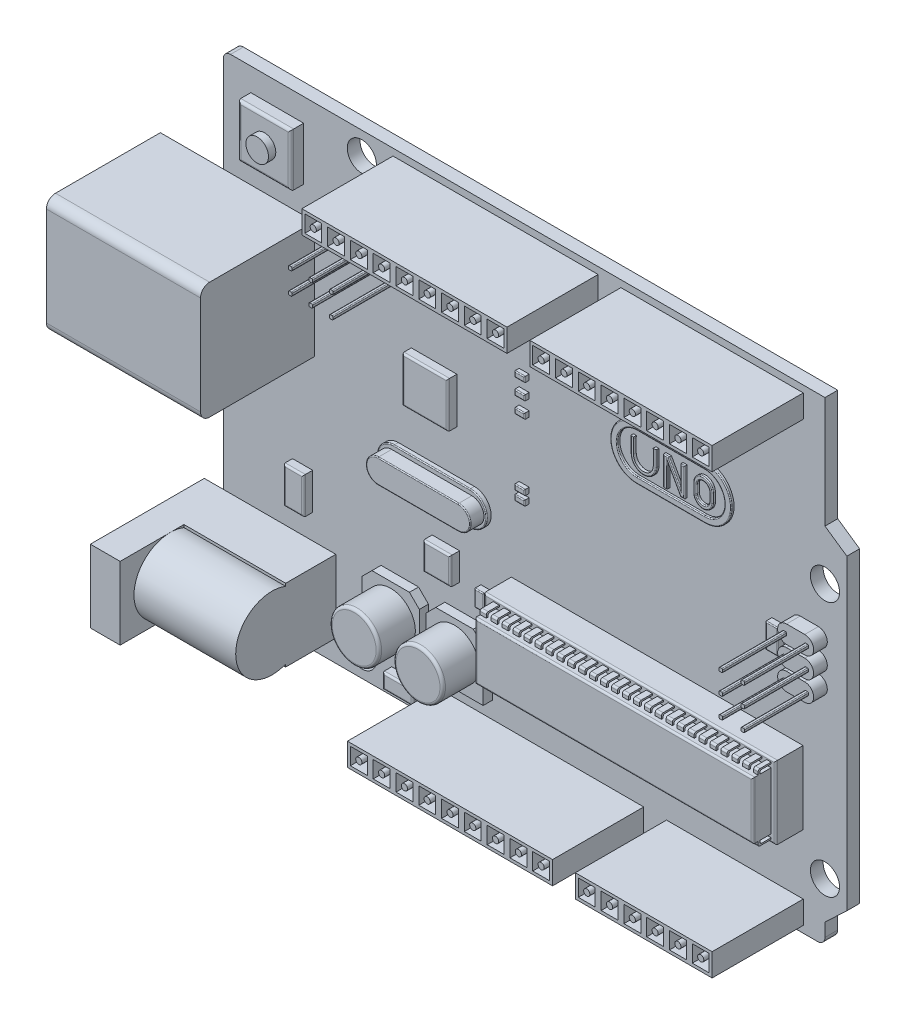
SolidWorks part; units mm, degrees
ref_plane "Front Plane" through (0, 0, 0) normal (0, 0, 1) x (1, 0, 0)
ref_plane "Top Plane" through (0, 0, 0) normal (0, 1, 0) x (1, 0, 0)
ref_plane "Right Plane" through (0, 0, 0) normal (1, 0, 0) x (0, 0, -1)
sketch "Sketch3" plane through (0, 0, 0) normal (0, 0, 1) x (1, 0, 0)
  line L0 (0, -26.04) -> (0, -19.66) construction
  line L1 (-32.2, -26.04) -> (32.2, -26.04)
  line L2 (-33, -25.24) -> (-33, 25.24)
  line L3 (-32.2, 26.04) -> (33, 26.04)
  line L4 (33, -25.24) -> (33, -23.7821)
  line L5 (-33, -26.04) -> (33, 26.04) construction
  line L6 (-33, 26.04) -> (33, -26.04) construction
  line L7 (0, -19.66) -> (45.2877, -19.66) construction
  line L9 (35.4, -19.66) -> (35.4, 12.175)
  line L10 (35.4, 12.175) -> (33, 13.8291)
  line L11 (33, 23.54) -> (-33, 23.54) construction
  line L12 (-17.8, 26.04) -> (-17.8, -26.04) construction
  line L13 (-27.8041, -21.94) -> (-33, -21.94) construction
  line L14 (35.4, -19.66) -> (35.4, -21.5172)
  line L15 (35.4, -21.5172) -> (33, -23.7821)
  line L17 (33, 13.8291) -> (33, 26.04)
  circle A0 centre (33, -19.66) radius 1.6
  circle A1 centre (33, 8.34) radius 1.6
  circle A2 centre (-17.8, 23.54) radius 1.6
  circle A3 centre (-17.8, -23.54) radius 1.6
  arc A4 (32.2, -26.04) -> (33, -25.24) centre (32.2, -25.24) ccw
  arc A5 (-33, -25.24) -> (-32.2, -26.04) centre (-32.2, -25.24) ccw
  arc A6 (-33, 25.24) -> (-32.2, 26.04) centre (-32.2, 25.24) cw
  point P0 (0, 0)
  dimension "D5" = 3.2
  dimension "D6" = 3.2
  dimension "D10" = 3.2
  dimension "D11" = 3.2
  dimension "D12" = 0.8
  dimension "D1" = 52.08
  dimension "D2" = 66
  dimension "D3" = 45.7
  dimension "D4" = 17.7
  dimension "D7" = 2.4
  dimension "D8" = 15.2
  dimension "D9" = 2.5
  dimension "D13" = 2.5
extrude "Boss-Extrude2" add sketch "Sketch3" along normal blind 1.4
sketch "Sketch4" plane through (0, 0, 1.4) normal (0, 0, 1) x (1, 0, 0)
  line L4 (33, -19.66) -> (-41.4928, -19.66) construction
  line L5 (33, 8.34) -> (-43.1807, 8.34) construction
  line L6 (-23, 2.7306) -> (-23, 1.9306)
  line L7 (-34.2816, -15.6787) -> (-21.4564, -15.6787)
  line L8 (-35.0816, -16.4787) -> (-35.0816, -22.8413)
  line L9 (-34.2816, -23.6413) -> (-21.4564, -23.6413)
  line L10 (-20.6564, -16.4787) -> (-20.6564, -22.8413)
  line L11 (-35.0816, -15.6787) -> (-20.6564, -23.6413) construction
  line L12 (-35.0816, -23.6413) -> (-20.6564, -15.6787) construction
  line L13 (-39.1023, 14.7494) -> (-23.8, 14.7494)
  line L14 (-39.9023, 13.9494) -> (-39.9023, 2.7306)
  line L15 (-39.1023, 1.9306) -> (-23.8, 1.9306)
  line L16 (-23, 13.9494) -> (-23, 2.7306)
  line L17 (-39.9023, 14.7494) -> (-23, 1.9306) construction
  line L18 (-39.9023, 1.9306) -> (-23, 14.7494) construction
  line L19 (-23, 1.9306) -> (-23.8, 1.9306)
  line L20 (-23, 13.9494) -> (-23, 14.7494)
  line L21 (-23, 14.7494) -> (-23.8, 14.7494)
  line L22 (-20.6564, -22.8413) -> (-20.6564, -23.6413)
  line L23 (-20.6564, -23.6413) -> (-21.4564, -23.6413)
  line L24 (-20.6564, -16.4787) -> (-20.6564, -15.6787)
  line L25 (-20.6564, -15.6787) -> (-21.4564, -15.6787)
  line L26 (-34.2816, -23.6413) -> (-35.0816, -23.6413)
  line L27 (-35.0816, -23.6413) -> (-35.0816, -22.8413)
  line L28 (-35.0816, -16.4787) -> (-35.0816, -15.6787)
  line L29 (-35.0816, -15.6787) -> (-34.2816, -15.6787)
  line L30 (-39.1023, 14.7494) -> (-39.9023, 14.7494)
  line L31 (-39.9023, 14.7494) -> (-39.9023, 13.9494)
  line L32 (-39.9023, 2.7306) -> (-39.9023, 1.9306)
  line L33 (-39.9023, 1.9306) -> (-39.1023, 1.9306)
  line L34 (-33, 25.24) -> (-33, -25.24) construction
  point P4 (-27.869, -19.66)
  point P11 (-31.4511, 8.34)
  dimension "D1" = 10
extrude "Boss-Extrude3" add sketch "Sketch4" along normal blind 12.5
sketch "Sketch5" plane through (0, 0, 13.9) normal (0, 0, 1) x (1, 0, 0)
  line L2 (-20.3205, -23.6413) -> (-20.3205, -15.6787)
  line L5 (-31.812, -15.6787) -> (-31.812, -23.6413)
  line L6 (-20.6564, -15.6787) -> (-33, -15.6787) construction
  line L7 (-35.0816, -23.6413) -> (-20.6564, -23.6413) construction
  line L8 (-31.812, -23.6413) -> (-20.3205, -23.6413)
  line L9 (-31.812, -15.6787) -> (-20.3205, -15.6787)
extrude "Cut-Extrude1" cut sketch "Sketch5" against normal blind 7
sketch "Sketch6" plane through (-31.812, 0, 0) normal (1, 0, 0) x (0, 0, -1)
  line L2 (-6.9, -19.66) -> (-8.4, -19.66) construction
  line L3 (-6.9, -23.6413) -> (-6.9, -15.6787) construction
  circle A1 centre (-8.4, -19.66) radius 3.9813
  dimension "D1" = 1.5
extrude "Boss-Extrude4" add sketch "Sketch6" along normal up to surface (11.1556 mm away)
sketch "Sketch8" plane through (-35.0816, 0, 0) normal (-1, 0, 0) x (0, 0, 1)
  line L0 (13.9, -19.66) -> (8.4, -19.66) construction
  line L1 (13.9, -15.6787) -> (13.9, -23.6413) construction
  line L2 (8.4, -19.66) -> (8.4, -14.4736) construction
  circle A0 centre (8.4, -19.66) radius 3
  circle A1 centre (8.4, -19.66) radius 0.7981
  dimension "D2" = 6
  dimension "D1" = 5.5
extrude "Cut-Extrude2" cut sketch "Sketch8" against normal blind 7
fillet "Fillet3" radius 0.5 1 edges at (-35.0816, -19.66, 9.1981)
sketch "Sketch9" plane through (-39.9023, 0, 0) normal (-1, 0, 0) x (0, 0, 1)
  line L0 (1.4, 8.34) -> (13.9, 8.34) construction
  line L1 (1.4, 14.7494) -> (1.4, 1.9306) construction
  line L2 (13.9, 14.7494) -> (13.9, 1.9306) construction
  line L3 (3.1, 3.6306) -> (3.1, 13.0494)
  line L4 (3.1, 13.0494) -> (9.8763, 13.0494)
  line L5 (9.8763, 13.0494) -> (12.2, 10.9476)
  line L6 (12.2, 10.9476) -> (12.2, 5.7324)
  line L7 (13.9, 14.7494) -> (1.4, 14.7494) construction
  line L8 (7.65, 8.34) -> (7.65, 13.5426) construction
  line L9 (6.1, 5.84) -> (6.1, 10.84)
  line L10 (6.1, 10.84) -> (9.2, 10.84)
  line L11 (9.2, 5.84) -> (9.2, 10.84)
  line L12 (6.1, 5.84) -> (9.2, 5.84)
  line L13 (9.8763, 3.6306) -> (12.2, 5.7324)
  line L14 (3.1, 3.6306) -> (9.8763, 3.6306)
  point P6 (7.65, 5.84)
  point P22 (7.65, 10.84)
  point P23 (9.2, 8.34)
  point P24 (6.1, 8.34)
  point P25 (12.2, 8.34)
  point P27 (3.1, 8.34)
  dimension "D1" = 1.7
  dimension "D2" = 1.7
  dimension "D3" = 1.7
  dimension "D4" = 3
  dimension "D5" = 2.5
extrude "Cut-Extrude3" cut sketch "Sketch9" against normal blind 10
fillet "Fillet4" radius 1 2 edges at (-31.4511, 14.7494, 13.9) (-31.4511, 1.9306, 13.9)
sketch "Sketch10" plane through (0, 0, 1.4) normal (0, 0, 1) x (1, 0, 0)
  line L1 (-29.9816, 23.5113) -> (-24.1816, 23.5113)
  line L2 (-29.9816, 23.5113) -> (-29.9816, 17.7113)
  line L3 (-29.9816, 17.7113) -> (-24.1816, 17.7113)
  line L4 (-24.1816, 23.5113) -> (-24.1816, 17.7113)
  line L5 (-29.9816, 23.5113) -> (-24.1816, 17.7113) construction
  line L6 (-29.9816, 17.7113) -> (-24.1816, 23.5113) construction
  point P0 (-27.0816, 20.6113)
  dimension "D1" = 5.8
  dimension "D2" = 5.8
extrude "Boss-Extrude5" add sketch "Sketch10" along normal blind 1.4
fillet "Fillet5" radius 0.3 4 edges at (-27.0816, 17.7113, 2.8) (-29.9816, 20.6113, 2.8) (-24.1816, 20.6113, 2.8) (-27.0816, 23.5113, 2.8)
sketch "Sketch11" plane through (0, 0, 2.8) normal (0, 0, 1) x (1, 0, 0)
  line L0 (-24.4816, 20.6113) -> (-29.6816, 20.6113) construction
  line L1 (-24.4816, 18.0113) -> (-24.4816, 23.2113) construction
  line L2 (-29.6816, 23.2113) -> (-29.6816, 18.0113) construction
  line L3 (-27.0816, 23.2113) -> (-27.0816, 18.0113) construction
  line L4 (-24.4816, 23.2113) -> (-29.6816, 23.2113) construction
  line L5 (-29.6816, 18.0113) -> (-24.4816, 18.0113) construction
  circle A0 centre (-27.0816, 20.6113) radius 1.2431
extrude "Boss-Extrude6" add sketch "Sketch11" along normal blind 0.8
sketch "Sketch15" plane through (0, 0, 1.4) normal (0, 0, 1) x (1, 0, 0)
  line L0 (-14.3813, 26.04) -> (-14.3813, 19.5503) construction
  line L1 (33, 26.04) -> (-32.2, 26.04) construction
  line L2 (30.6187, 26.04) -> (30.6187, 22.38) construction
  line L3 (33, 24.04) -> (-14.3813, 24.04) construction
  line L4 (33, 13.8291) -> (33, 26.04) construction
  line L5 (-9.7064, 23.1151) -> (-9.7064, 24.9649)
  line L6 (-11.8813, 22.79) -> (-14.3813, 22.79)
  line L7 (-11.8813, 22.79) -> (-11.8813, 25.29)
  line L8 (-11.8813, 25.29) -> (-14.3813, 25.29)
  line L9 (-14.3813, 22.79) -> (-14.3813, 25.29)
  line L10 (-11.8813, 22.79) -> (-14.3813, 25.29) construction
  line L11 (-11.8813, 25.29) -> (-14.3813, 22.79) construction
  line L12 (-14.0563, 23.1151) -> (-12.2064, 23.1151)
  line L13 (-14.0563, 23.1151) -> (-14.0563, 24.9649)
  line L14 (-14.0563, 24.9649) -> (-12.2064, 24.9649)
  line L15 (-12.2064, 23.1151) -> (-12.2064, 24.9649)
  line L16 (-14.0563, 23.1151) -> (-12.2064, 24.9649) construction
  line L17 (-14.0563, 24.9649) -> (-12.2064, 23.1151) construction
  line L18 (-11.5563, 24.9649) -> (-9.7064, 24.9649)
  line L19 (-11.5563, 23.1151) -> (-11.5563, 24.9649)
  line L20 (-11.5563, 23.1151) -> (-9.7064, 23.1151)
  line L21 (-9.3813, 22.79) -> (-9.3813, 25.29)
  line L22 (-9.3813, 25.29) -> (-11.8813, 25.29)
  line L23 (-11.8813, 22.79) -> (-11.8813, 25.29)
  line L24 (-9.3813, 22.79) -> (-11.8813, 22.79)
  line L25 (-7.2064, 23.1151) -> (-7.2064, 24.9649)
  line L26 (-9.0563, 24.9649) -> (-7.2064, 24.9649)
  line L27 (-9.0563, 23.1151) -> (-9.0563, 24.9649)
  line L28 (-9.0563, 23.1151) -> (-7.2064, 23.1151)
  line L29 (-6.8813, 22.79) -> (-6.8813, 25.29)
  line L30 (-6.8813, 25.29) -> (-9.3813, 25.29)
  line L31 (-9.3813, 22.79) -> (-9.3813, 25.29)
  line L32 (-6.8813, 22.79) -> (-9.3813, 22.79)
  line L33 (-4.7064, 23.1151) -> (-4.7064, 24.9649)
  line L34 (-6.5563, 24.9649) -> (-4.7064, 24.9649)
  line L35 (-6.5563, 23.1151) -> (-6.5563, 24.9649)
  line L36 (-6.5563, 23.1151) -> (-4.7064, 23.1151)
  line L37 (-4.3813, 22.79) -> (-4.3813, 25.29)
  line L38 (-4.3813, 25.29) -> (-6.8813, 25.29)
  line L39 (-6.8813, 22.79) -> (-6.8813, 25.29)
  line L40 (-4.3813, 22.79) -> (-6.8813, 22.79)
  line L41 (-2.2064, 23.1151) -> (-2.2064, 24.9649)
  line L42 (-4.0563, 24.9649) -> (-2.2064, 24.9649)
  line L43 (-4.0563, 23.1151) -> (-4.0563, 24.9649)
  line L44 (-4.0563, 23.1151) -> (-2.2064, 23.1151)
  line L45 (-1.8813, 22.79) -> (-1.8813, 25.29)
  line L46 (-1.8813, 25.29) -> (-4.3813, 25.29)
  line L47 (-4.3813, 22.79) -> (-4.3813, 25.29)
  line L48 (-1.8813, 22.79) -> (-4.3813, 22.79)
  line L49 (0.2936, 23.1151) -> (0.2936, 24.9649)
  line L50 (-1.5563, 24.9649) -> (0.2936, 24.9649)
  line L51 (-1.5563, 23.1151) -> (-1.5563, 24.9649)
  line L52 (-1.5563, 23.1151) -> (0.2936, 23.1151)
  line L53 (0.6187, 22.79) -> (0.6187, 25.29)
  line L54 (0.6187, 25.29) -> (-1.8813, 25.29)
  line L55 (-1.8813, 22.79) -> (-1.8813, 25.29)
  line L56 (0.6187, 22.79) -> (-1.8813, 22.79)
  line L57 (2.7936, 23.1151) -> (2.7936, 24.9649)
  line L58 (0.9437, 24.9649) -> (2.7936, 24.9649)
  line L59 (0.9437, 23.1151) -> (0.9437, 24.9649)
  line L60 (0.9437, 23.1151) -> (2.7936, 23.1151)
  line L61 (3.1187, 22.79) -> (3.1187, 25.29)
  line L62 (3.1187, 25.29) -> (0.6187, 25.29)
  line L63 (0.6187, 22.79) -> (0.6187, 25.29)
  line L64 (3.1187, 22.79) -> (0.6187, 22.79)
  line L65 (5.2936, 23.1151) -> (5.2936, 24.9649)
  line L66 (3.4437, 24.9649) -> (5.2936, 24.9649)
  line L67 (3.4437, 23.1151) -> (3.4437, 24.9649)
  line L68 (3.4437, 23.1151) -> (5.2936, 23.1151)
  line L69 (5.6187, 22.79) -> (5.6187, 25.29)
  line L70 (5.6187, 25.29) -> (3.1187, 25.29)
  line L71 (3.1187, 22.79) -> (3.1187, 25.29)
  line L72 (5.6187, 22.79) -> (3.1187, 22.79)
  line L73 (7.7936, 23.1151) -> (7.7936, 24.9649)
  line L74 (5.9437, 24.9649) -> (7.7936, 24.9649)
  line L75 (5.9437, 23.1151) -> (5.9437, 24.9649)
  line L76 (5.9437, 23.1151) -> (7.7936, 23.1151)
  line L77 (8.1187, 22.79) -> (8.1187, 25.29)
  line L78 (8.1187, 25.29) -> (5.6187, 25.29)
  line L79 (5.6187, 22.79) -> (5.6187, 25.29)
  line L80 (8.1187, 22.79) -> (5.6187, 22.79)
  line L81 (10.2936, 23.1151) -> (10.2936, 24.9649)
  line L82 (8.4437, 24.9649) -> (10.2936, 24.9649)
  line L83 (8.4437, 23.1151) -> (8.4437, 24.9649)
  line L84 (8.4437, 23.1151) -> (10.2936, 23.1151)
  line L85 (10.6187, 22.79) -> (10.6187, 25.29)
  line L86 (10.6187, 25.29) -> (8.1187, 25.29)
  line L87 (8.1187, 22.79) -> (8.1187, 25.29)
  line L88 (10.6187, 22.79) -> (8.1187, 22.79)
  line L89 (12.7936, 23.1151) -> (12.7936, 24.9649)
  line L90 (10.9437, 24.9649) -> (12.7936, 24.9649)
  line L91 (10.9437, 23.1151) -> (10.9437, 24.9649)
  line L92 (10.9437, 23.1151) -> (12.7936, 23.1151)
  line L93 (13.1187, 22.79) -> (13.1187, 25.29)
  line L94 (13.1187, 25.29) -> (10.6187, 25.29)
  line L95 (10.6187, 22.79) -> (10.6187, 25.29)
  line L96 (13.1187, 22.79) -> (10.6187, 22.79)
  line L97 (15.2936, 23.1151) -> (15.2936, 24.9649)
  line L98 (13.4437, 24.9649) -> (15.2936, 24.9649)
  line L99 (13.4437, 23.1151) -> (13.4437, 24.9649)
  line L100 (13.4437, 23.1151) -> (15.2936, 23.1151)
  line L101 (15.6187, 22.79) -> (15.6187, 25.29)
  line L102 (15.6187, 25.29) -> (13.1187, 25.29)
  line L103 (13.1187, 22.79) -> (13.1187, 25.29)
  line L104 (15.6187, 22.79) -> (13.1187, 22.79)
  line L105 (17.7936, 23.1151) -> (17.7936, 24.9649)
  line L106 (15.9437, 24.9649) -> (17.7936, 24.9649)
  line L107 (15.9437, 23.1151) -> (15.9437, 24.9649)
  line L108 (15.9437, 23.1151) -> (17.7936, 23.1151)
  line L109 (18.1187, 22.79) -> (18.1187, 25.29)
  line L110 (18.1187, 25.29) -> (15.6187, 25.29)
  line L111 (15.6187, 22.79) -> (15.6187, 25.29)
  line L112 (18.1187, 22.79) -> (15.6187, 22.79)
  line L113 (20.2936, 23.1151) -> (20.2936, 24.9649)
  line L114 (18.4437, 24.9649) -> (20.2936, 24.9649)
  line L115 (18.4437, 23.1151) -> (18.4437, 24.9649)
  line L116 (18.4437, 23.1151) -> (20.2936, 23.1151)
  line L117 (20.6187, 22.79) -> (20.6187, 25.29)
  line L118 (20.6187, 25.29) -> (18.1187, 25.29)
  line L119 (18.1187, 22.79) -> (18.1187, 25.29)
  line L120 (20.6187, 22.79) -> (18.1187, 22.79)
  line L121 (22.7936, 23.1151) -> (22.7936, 24.9649)
  line L122 (20.9437, 24.9649) -> (22.7936, 24.9649)
  line L123 (20.9437, 23.1151) -> (20.9437, 24.9649)
  line L124 (20.9437, 23.1151) -> (22.7936, 23.1151)
  line L125 (23.1187, 22.79) -> (23.1187, 25.29)
  line L126 (23.1187, 25.29) -> (20.6187, 25.29)
  line L127 (20.6187, 22.79) -> (20.6187, 25.29)
  line L128 (23.1187, 22.79) -> (20.6187, 22.79)
  line L129 (25.2936, 23.1151) -> (25.2936, 24.9649)
  line L130 (23.4437, 24.9649) -> (25.2936, 24.9649)
  line L131 (23.4437, 23.1151) -> (23.4437, 24.9649)
  line L132 (23.4437, 23.1151) -> (25.2936, 23.1151)
  line L133 (25.6187, 22.79) -> (25.6187, 25.29)
  line L134 (25.6187, 25.29) -> (23.1187, 25.29)
  line L135 (23.1187, 22.79) -> (23.1187, 25.29)
  line L136 (25.6187, 22.79) -> (23.1187, 22.79)
  line L137 (27.7936, 23.1151) -> (27.7936, 24.9649)
  line L138 (25.9437, 24.9649) -> (27.7936, 24.9649)
  line L139 (25.9437, 23.1151) -> (25.9437, 24.9649)
  line L140 (25.9437, 23.1151) -> (27.7936, 23.1151)
  line L141 (28.1187, 22.79) -> (28.1187, 25.29)
  line L142 (28.1187, 25.29) -> (25.6187, 25.29)
  line L143 (25.6187, 22.79) -> (25.6187, 25.29)
  line L144 (28.1187, 22.79) -> (25.6187, 22.79)
  line L145 (30.2936, 23.1151) -> (30.2936, 24.9649)
  line L146 (28.4437, 24.9649) -> (30.2936, 24.9649)
  line L147 (28.4437, 23.1151) -> (28.4437, 24.9649)
  line L148 (28.4437, 23.1151) -> (30.2936, 23.1151)
  line L149 (30.6187, 22.79) -> (30.6187, 25.29)
  line L150 (30.6187, 25.29) -> (28.1187, 25.29)
  line L151 (28.1187, 22.79) -> (28.1187, 25.29)
  line L152 (30.6187, 22.79) -> (28.1187, 22.79)
  line L153 (0, 0) -> (19.3687, 0) construction
  line L154 (30.6187, -26.04) -> (30.6187, -22.38) construction
  line L155 (28.1187, -22.79) -> (28.1187, -25.29)
  line L156 (30.6187, -25.29) -> (28.1187, -25.29)
  line L157 (30.6187, -22.79) -> (30.6187, -25.29)
  line L158 (28.4437, -24.9649) -> (30.2936, -24.9649)
  line L159 (30.2936, -23.1151) -> (30.2936, -24.9649)
  line L160 (28.1187, -25.29) -> (25.6187, -25.29)
  line L161 (28.1187, -22.79) -> (28.1187, -25.29)
  line L162 (-14.0563, -24.9649) -> (-12.2064, -23.1151) construction
  line L163 (-14.0563, -23.1151) -> (-12.2064, -24.9649) construction
  line L164 (-11.8813, -25.29) -> (-14.3813, -22.79) construction
  line L165 (-11.8813, -22.79) -> (-14.3813, -25.29) construction
  line L166 (30.6187, -22.79) -> (28.1187, -22.79)
  line L167 (28.4437, -23.1151) -> (30.2936, -23.1151)
  line L168 (28.4437, -23.1151) -> (28.4437, -24.9649)
  line L169 (28.1187, -22.79) -> (25.6187, -22.79)
  line L170 (25.6187, -22.79) -> (25.6187, -25.29)
  line L171 (25.9437, -23.1151) -> (27.7936, -23.1151)
  line L172 (25.9437, -23.1151) -> (25.9437, -24.9649)
  line L173 (25.9437, -24.9649) -> (27.7936, -24.9649)
  line L174 (27.7936, -23.1151) -> (27.7936, -24.9649)
  line L175 (25.6187, -22.79) -> (23.1187, -22.79)
  line L176 (23.1187, -22.79) -> (23.1187, -25.29)
  line L177 (25.6187, -25.29) -> (23.1187, -25.29)
  line L178 (25.6187, -22.79) -> (25.6187, -25.29)
  line L179 (23.4437, -23.1151) -> (25.2936, -23.1151)
  line L180 (23.4437, -23.1151) -> (23.4437, -24.9649)
  line L181 (23.4437, -24.9649) -> (25.2936, -24.9649)
  line L182 (25.2936, -23.1151) -> (25.2936, -24.9649)
  line L183 (23.1187, -22.79) -> (20.6187, -22.79)
  line L184 (20.6187, -22.79) -> (20.6187, -25.29)
  line L185 (23.1187, -25.29) -> (20.6187, -25.29)
  line L186 (23.1187, -22.79) -> (23.1187, -25.29)
  line L187 (20.9437, -23.1151) -> (22.7936, -23.1151)
  line L188 (20.9437, -23.1151) -> (20.9437, -24.9649)
  line L189 (20.9437, -24.9649) -> (22.7936, -24.9649)
  line L190 (22.7936, -23.1151) -> (22.7936, -24.9649)
  line L191 (20.6187, -22.79) -> (18.1187, -22.79)
  line L192 (18.1187, -22.79) -> (18.1187, -25.29)
  line L193 (20.6187, -25.29) -> (18.1187, -25.29)
  line L194 (20.6187, -22.79) -> (20.6187, -25.29)
  line L195 (18.4437, -23.1151) -> (20.2936, -23.1151)
  line L196 (18.4437, -23.1151) -> (18.4437, -24.9649)
  line L197 (18.4437, -24.9649) -> (20.2936, -24.9649)
  line L198 (20.2936, -23.1151) -> (20.2936, -24.9649)
  line L199 (18.1187, -22.79) -> (15.6187, -22.79)
  line L200 (15.6187, -22.79) -> (15.6187, -25.29)
  line L201 (18.1187, -25.29) -> (15.6187, -25.29)
  line L202 (18.1187, -22.79) -> (18.1187, -25.29)
  line L203 (15.9437, -23.1151) -> (17.7936, -23.1151)
  line L204 (15.9437, -23.1151) -> (15.9437, -24.9649)
  line L205 (15.9437, -24.9649) -> (17.7936, -24.9649)
  line L206 (17.7936, -23.1151) -> (17.7936, -24.9649)
  line L207 (15.6187, -22.79) -> (13.1187, -22.79)
  line L208 (13.1187, -22.79) -> (13.1187, -25.29)
  line L209 (15.6187, -25.29) -> (13.1187, -25.29)
  line L210 (15.6187, -22.79) -> (15.6187, -25.29)
  line L211 (13.4437, -23.1151) -> (15.2936, -23.1151)
  line L212 (13.4437, -23.1151) -> (13.4437, -24.9649)
  line L213 (13.4437, -24.9649) -> (15.2936, -24.9649)
  line L214 (15.2936, -23.1151) -> (15.2936, -24.9649)
  line L215 (13.1187, -22.79) -> (10.6187, -22.79)
  line L216 (10.6187, -22.79) -> (10.6187, -25.29)
  line L217 (13.1187, -25.29) -> (10.6187, -25.29)
  line L218 (13.1187, -22.79) -> (13.1187, -25.29)
  line L219 (10.9437, -23.1151) -> (12.7936, -23.1151)
  line L220 (10.9437, -23.1151) -> (10.9437, -24.9649)
  line L221 (10.9437, -24.9649) -> (12.7936, -24.9649)
  line L222 (12.7936, -23.1151) -> (12.7936, -24.9649)
  line L223 (10.6187, -22.79) -> (8.1187, -22.79)
  line L224 (8.1187, -22.79) -> (8.1187, -25.29)
  line L225 (10.6187, -25.29) -> (8.1187, -25.29)
  line L226 (10.6187, -22.79) -> (10.6187, -25.29)
  line L227 (8.4437, -23.1151) -> (10.2936, -23.1151)
  line L228 (8.4437, -23.1151) -> (8.4437, -24.9649)
  line L229 (8.4437, -24.9649) -> (10.2936, -24.9649)
  line L230 (10.2936, -23.1151) -> (10.2936, -24.9649)
  line L231 (8.1187, -22.79) -> (5.6187, -22.79)
  line L232 (5.6187, -22.79) -> (5.6187, -25.29)
  line L233 (8.1187, -25.29) -> (5.6187, -25.29)
  line L234 (8.1187, -22.79) -> (8.1187, -25.29)
  line L235 (5.9437, -23.1151) -> (7.7936, -23.1151)
  line L236 (5.9437, -23.1151) -> (5.9437, -24.9649)
  line L237 (5.9437, -24.9649) -> (7.7936, -24.9649)
  line L238 (7.7936, -23.1151) -> (7.7936, -24.9649)
  line L239 (5.6187, -22.79) -> (3.1187, -22.79)
  line L240 (3.1187, -22.79) -> (3.1187, -25.29)
  line L241 (5.6187, -25.29) -> (3.1187, -25.29)
  line L242 (5.6187, -22.79) -> (5.6187, -25.29)
  line L243 (3.4437, -23.1151) -> (5.2936, -23.1151)
  line L244 (3.4437, -23.1151) -> (3.4437, -24.9649)
  line L245 (3.4437, -24.9649) -> (5.2936, -24.9649)
  line L246 (5.2936, -23.1151) -> (5.2936, -24.9649)
  line L247 (3.1187, -22.79) -> (0.6187, -22.79)
  line L248 (0.6187, -22.79) -> (0.6187, -25.29)
  line L249 (3.1187, -25.29) -> (0.6187, -25.29)
  line L250 (3.1187, -22.79) -> (3.1187, -25.29)
  line L251 (0.9437, -23.1151) -> (2.7936, -23.1151)
  line L252 (0.9437, -23.1151) -> (0.9437, -24.9649)
  line L253 (0.9437, -24.9649) -> (2.7936, -24.9649)
  line L254 (2.7936, -23.1151) -> (2.7936, -24.9649)
  line L255 (0.6187, -22.79) -> (-1.8813, -22.79)
  line L256 (-1.8813, -22.79) -> (-1.8813, -25.29)
  line L257 (0.6187, -25.29) -> (-1.8813, -25.29)
  line L258 (0.6187, -22.79) -> (0.6187, -25.29)
  line L259 (-1.5563, -23.1151) -> (0.2936, -23.1151)
  line L260 (-1.5563, -23.1151) -> (-1.5563, -24.9649)
  line L261 (-1.5563, -24.9649) -> (0.2936, -24.9649)
  line L262 (0.2936, -23.1151) -> (0.2936, -24.9649)
  line L263 (-1.8813, -22.79) -> (-4.3813, -22.79)
  line L264 (-4.3813, -22.79) -> (-4.3813, -25.29)
  line L265 (-1.8813, -25.29) -> (-4.3813, -25.29)
  line L266 (-1.8813, -22.79) -> (-1.8813, -25.29)
  line L267 (-4.0563, -23.1151) -> (-2.2064, -23.1151)
  line L268 (-4.0563, -23.1151) -> (-4.0563, -24.9649)
  line L269 (-4.0563, -24.9649) -> (-2.2064, -24.9649)
  line L270 (-2.2064, -23.1151) -> (-2.2064, -24.9649)
  line L271 (-4.3813, -22.79) -> (-6.8813, -22.79)
  line L272 (-6.8813, -22.79) -> (-6.8813, -25.29)
  line L273 (-4.3813, -25.29) -> (-6.8813, -25.29)
  line L274 (-4.3813, -22.79) -> (-4.3813, -25.29)
  line L275 (-6.5563, -23.1151) -> (-4.7064, -23.1151)
  line L276 (-6.5563, -23.1151) -> (-6.5563, -24.9649)
  line L277 (-6.5563, -24.9649) -> (-4.7064, -24.9649)
  line L278 (-4.7064, -23.1151) -> (-4.7064, -24.9649)
  line L279 (-6.8813, -22.79) -> (-9.3813, -22.79)
  line L280 (-9.3813, -22.79) -> (-9.3813, -25.29)
  line L281 (-6.8813, -25.29) -> (-9.3813, -25.29)
  line L282 (-6.8813, -22.79) -> (-6.8813, -25.29)
  line L283 (-9.0563, -23.1151) -> (-7.2064, -23.1151)
  line L284 (-9.0563, -23.1151) -> (-9.0563, -24.9649)
  line L285 (-9.0563, -24.9649) -> (-7.2064, -24.9649)
  line L286 (-7.2064, -23.1151) -> (-7.2064, -24.9649)
  line L287 (-9.3813, -22.79) -> (-11.8813, -22.79)
  line L288 (-11.8813, -22.79) -> (-11.8813, -25.29)
  line L289 (-9.3813, -25.29) -> (-11.8813, -25.29)
  line L290 (-9.3813, -22.79) -> (-9.3813, -25.29)
  line L291 (-11.5563, -23.1151) -> (-9.7064, -23.1151)
  line L292 (-11.5563, -23.1151) -> (-11.5563, -24.9649)
  line L293 (-11.5563, -24.9649) -> (-9.7064, -24.9649)
  line L294 (-12.2064, -23.1151) -> (-12.2064, -24.9649)
  line L295 (-14.0563, -24.9649) -> (-12.2064, -24.9649)
  line L296 (-14.0563, -23.1151) -> (-14.0563, -24.9649)
  line L297 (-14.0563, -23.1151) -> (-12.2064, -23.1151)
  line L298 (-14.3813, -22.79) -> (-14.3813, -25.29)
  line L299 (-11.8813, -25.29) -> (-14.3813, -25.29)
  line L300 (-11.8813, -22.79) -> (-11.8813, -25.29)
  line L301 (-11.8813, -22.79) -> (-14.3813, -22.79)
  line L302 (-9.7064, -23.1151) -> (-9.7064, -24.9649)
  circle A0 centre (-13.1313, 24.04) radius 0.34
  circle A1 centre (-10.6313, 24.04) radius 0.34
  circle A2 centre (-8.1313, 24.04) radius 0.34
  circle A3 centre (-5.6313, 24.04) radius 0.34
  circle A4 centre (-3.1313, 24.04) radius 0.34
  circle A5 centre (-0.6313, 24.04) radius 0.34
  circle A6 centre (1.8687, 24.04) radius 0.34
  circle A7 centre (4.3687, 24.04) radius 0.34
  circle A8 centre (6.8687, 24.04) radius 0.34
  circle A9 centre (9.3687, 24.04) radius 0.34
  circle A10 centre (11.8687, 24.04) radius 0.34
  circle A11 centre (14.3687, 24.04) radius 0.34
  circle A12 centre (16.8687, 24.04) radius 0.34
  circle A13 centre (19.3687, 24.04) radius 0.34
  circle A14 centre (21.8687, 24.04) radius 0.34
  circle A15 centre (24.3687, 24.04) radius 0.34
  circle A16 centre (26.8687, 24.04) radius 0.34
  circle A17 centre (29.3687, 24.04) radius 0.34
  circle A18 centre (29.3687, -24.04) radius 0.34
  circle A19 centre (26.8687, -24.04) radius 0.34
  circle A20 centre (24.3687, -24.04) radius 0.34
  circle A21 centre (21.8687, -24.04) radius 0.34
  circle A22 centre (19.3687, -24.04) radius 0.34
  circle A23 centre (16.8687, -24.04) radius 0.34
  circle A24 centre (14.3687, -24.04) radius 0.34
  circle A25 centre (11.8687, -24.04) radius 0.34
  circle A26 centre (9.3687, -24.04) radius 0.34
  circle A27 centre (6.8687, -24.04) radius 0.34
  circle A28 centre (4.3687, -24.04) radius 0.34
  circle A29 centre (1.8687, -24.04) radius 0.34
  circle A30 centre (-0.6313, -24.04) radius 0.34
  circle A31 centre (-3.1313, -24.04) radius 0.34
  circle A32 centre (-5.6313, -24.04) radius 0.34
  circle A33 centre (-8.1313, -24.04) radius 0.34
  circle A34 centre (-10.6313, -24.04) radius 0.34
  circle A35 centre (-13.1313, -24.04) radius 0.34
  point P8 (-13.1313, 24.04)
  point P15 (-13.1313, 24.04)
  dimension "D1" = 2.5
  dimension "D2" = 45
  dimension "D3" = 2
  dimension "D4" = 2.5
  dimension "D5" = 18
extrude "Boss-Extrude9" add sketch "Sketch15" along normal blind 10 contours L9 L6 L7 L8 L15 L12 L13 L14 | A0 | A1 | L24 L21 L22 L7 L20 L19 L18 L5 | A2 | L32 L29 L30 L21 L28 L27 L26 L25 | A3 | L40 L37 L38 L29 L36 L35 L34 L33 | A4 | L48 L45 L46 L37 L44 L43 L42 L41 | L64 L61 L62 L53 L60 L59 L58 L57 | L56 L53 L54 L45 L52 L51 L50 L49 | A5 | A6 | A7 | L72 L69 L70 L61 L68 L67 L66 L65 | L80 L77 L78 L69 L76 L75 L74 L73 | L152 L149 L150 L141 L148 L147 L146 L145 | A17 | L144 L141 L142 L133 L140 L139 L138 L137 | A16 | L136 L133 L134 L125 L132 L131 L130 L129 | L128 L125 L126 L117 L124 L123 L122 L121 | A14 | L120 L117 L118 L109 L116 L115 L114 L113 | A13 | L112 L109 L110 L101 L108 L107 L106 L105 | A12 | L104 L101 L102 L93 L100 L99 L98 L97 | A11 | L96 L93 L94 L85 L92 L91 L90 L89 | A8 | A15 | A10
mirror "Mirror2" about plane through (0, 0, 0) normal (0, 1, 0) of "Boss-Extrude9"
sketch "Sketch16" plane through (0, 0, 1.4) normal (0, 0, 1) x (1, 0, 0)
  line L4 (10.2936, -23.1151) -> (10.2936, -24.9649)
  line L5 (8.4437, -23.1151) -> (10.2936, -23.1151)
  line L6 (8.4437, -24.9649) -> (8.4437, -23.1151)
  line L7 (10.2936, -24.9649) -> (8.4437, -24.9649)
  line L8 (10.6187, -22.79) -> (8.1187, -22.79)
  line L10 (10.6187, -22.79) -> (10.6187, -25.29)
  line L11 (10.6187, -25.29) -> (8.1187, -25.29)
  line L12 (8.1187, -25.29) -> (8.1187, -22.79)
  circle A1 centre (9.3687, -24.04) radius 0.34
extrude "Boss-Extrude10" add sketch "Sketch16" along normal blind 10 contours L11 L8 L4 L7 L6 L5 M51 M11 | A1
sketch "Sketch17" plane through (0, 0, 1.4) normal (0, 0, 1) x (1, 0, 0)
  line L0 (-14.3813, -22.79) -> (-14.3813, -25.29)
  line L1 (-14.3813, -25.29) -> (-11.8813, -25.29)
  line L2 (30.6187, -25.29) -> (-14.3813, -25.29) construction
  line L4 (30.6187, -22.79) -> (-14.3813, -22.79) construction
  line L5 (-11.8813, -22.79) -> (-14.3813, -22.79)
  line L6 (-9.3813, -22.79) -> (-11.8813, -22.79)
  line L7 (-9.3813, -25.29) -> (-9.3813, -22.79)
  line L8 (-11.8813, -25.29) -> (-9.3813, -25.29)
  line L9 (-11.8813, -22.79) -> (-11.8813, -25.29)
  line L10 (13.1187, -22.79) -> (13.1187, -25.29)
  line L11 (15.6187, -22.79) -> (13.1187, -22.79)
  line L12 (15.6187, -25.29) -> (15.6187, -22.79)
  line L13 (13.1187, -25.29) -> (15.6187, -25.29)
  dimension "D1" = 2.5
  dimension "D2" = 2
  dimension "D3" = 2
extrude "Cut-Extrude5" cut sketch "Sketch17" along normal blind 10 contours L12 L10 M45 M47 | L9 L7 M47 M45 | L9 M47 M46 M45
sketch "Sketch18" plane through (0, 0, 1.4) normal (0, 0, 1) x (1, 0, 0)
  line L0 (-14.7796, -21.9649) -> (-14.7796, -16.3314)
  line L1 (-14.7796, -16.3314) -> (-13.6948, -15.2465)
  line L6 (-14.7796, -21.9649) -> (-8.4939, -21.9649)
  line L7 (-8.4939, -21.9649) -> (-8.4939, -16.3314)
  line L8 (-8.4939, -16.3314) -> (-9.5787, -15.2465)
  line L9 (-9.5787, -15.2465) -> (-13.6948, -15.2465)
  line L10 (-7.7796, -21.9649) -> (-7.7796, -16.3314)
  line L11 (-7.7796, -16.3314) -> (-6.6948, -15.2465)
  line L12 (-2.5787, -15.2465) -> (-6.6948, -15.2465)
  line L13 (-1.4939, -16.3314) -> (-2.5787, -15.2465)
  line L14 (-1.4939, -21.9649) -> (-1.4939, -16.3314)
  line L15 (-7.7796, -21.9649) -> (-1.4939, -21.9649)
  dimension "D1" = 2
extrude "Boss-Extrude11" add sketch "Sketch18" along normal blind 1
sketch "Sketch19" plane through (0, 0, 2.4) normal (0, 0, 1) x (1, 0, 0)
  line L0 (-13.6367, -20.9649) -> (-13.6367, -14.2465) construction
  line L1 (-16.7796, -20.9649) -> (-10.4939, -20.9649) construction
  line L2 (-11.5787, -14.2465) -> (-15.6948, -14.2465) construction
  circle A0 centre (-13.6367, -17.6057) radius 2.707
  circle A1 centre (-6.6367, -17.6057) radius 2.707
  dimension "D1" = 2
extrude "Boss-Extrude12" add sketch "Sketch19" along normal blind 4
fillet "Fillet6" radius 0.3 2 edges at (-10.9297, -17.6057, 6.4) (-3.9297, -17.6057, 6.4)
sketch "Sketch20" plane through (0, 0, 1.4) normal (0, 0, 1) x (1, 0, 0)
  line L1 (-13.8009, -5.3234) -> (-5.4594, -5.3234)
  line L3 (-13.8009, -1.6339) -> (-5.4594, -1.6339)
  line L5 (-13.8009, -5.3234) -> (-5.4594, -1.6339) construction
  line L6 (-13.8009, -1.6339) -> (-5.4594, -5.3234) construction
  line L7 (-12.4568, 9.1669) -> (-7.4568, 9.1669)
  line L8 (-12.4568, 9.1669) -> (-12.4568, 4.1669)
  line L9 (-12.4568, 4.1669) -> (-7.4568, 4.1669)
  line L10 (-7.4568, 9.1669) -> (-7.4568, 4.1669)
  line L11 (-12.4568, 9.1669) -> (-7.4568, 4.1669) construction
  line L12 (-12.4568, 4.1669) -> (-7.4568, 9.1669) construction
  arc A0 (-5.4594, -5.3234) -> (-5.4594, -1.6339) centre (-5.4594, -3.4787) ccw
  arc A1 (-13.8009, -1.6339) -> (-13.8009, -5.3234) centre (-13.8009, -3.4787) ccw
  point P0 (-9.6301, -3.4787)
  point P6 (-9.9568, 6.6669)
  dimension "D1" = 5
  dimension "D2" = 5
extrude "Boss-Extrude13" add sketch "Sketch20" along normal blind 0.5 contours L3 A0 L1 A1
sketch "Sketch21" plane through (0, 0, 1.9) normal (0, 0, 1) x (1, 0, 0)
  line L0 (-9.6301, -1.6339) -> (-9.6301, -5.3234) construction
  line L1 (-13.8009, -1.6339) -> (-5.4594, -1.6339) construction
  line L2 (-13.8009, -5.3234) -> (-5.4594, -5.3234) construction
  line L4 (-14.0301, -2.1537) -> (-5.2301, -2.1537)
  line L6 (-14.0301, -4.8037) -> (-5.2301, -4.8037)
  line L8 (-14.0301, -2.1537) -> (-5.2301, -4.8037) construction
  line L9 (-14.0301, -4.8037) -> (-5.2301, -2.1537) construction
  arc A0 (-14.0301, -2.1537) -> (-14.0301, -4.8037) centre (-14.0301, -3.4787) ccw
  arc A1 (-5.2301, -4.8037) -> (-5.2301, -2.1537) centre (-5.2301, -3.4787) ccw
  point P6 (-9.6301, -3.4787)
  dimension "D1" = 8.8
  dimension "D2" = 2.65
extrude "Boss-Extrude14" add sketch "Sketch21" along normal blind 1.5
fillet "Fillet7" radius 0.1 4 edges at (-9.6301, -5.3234, 1.9) (-15.6456, -3.4787, 1.9) (-9.6301, -1.6339, 1.9) (-3.6147, -3.4787, 1.9)
fillet "Fillet8" radius 0.1 4 edges at (-3.9051, -3.4787, 3.4) (-9.6301, -4.8037, 3.4) (-15.3551, -3.4787, 3.4) (-9.6301, -2.1537, 3.4)
sketch "Sketch22" plane through (0, 0, 1.4) normal (0, 0, 1) x (1, 0, 0)
  line L0 (-15.1543, 19.2882) -> (-15.1543, 17.2882) construction
  line L1 (-14.188, 19.2882) -> (-14.188, 17.2882)
  line L2 (-16.1207, 19.2882) -> (-16.1207, 17.2882)
  line L3 (-12.9043, 19.2882) -> (-12.9043, 17.2882) construction
  line L4 (-11.938, 19.2882) -> (-11.938, 17.2882)
  line L5 (-13.8707, 19.2882) -> (-13.8707, 17.2882)
  line L6 (-10.6543, 19.2882) -> (-10.6543, 17.2882) construction
  line L7 (-9.688, 19.2882) -> (-9.688, 17.2882)
  line L8 (-11.6207, 19.2882) -> (-11.6207, 17.2882)
  arc A0 (-14.188, 19.2882) -> (-16.1207, 19.2882) centre (-15.1543, 19.2882) ccw
  arc A1 (-16.1207, 17.2882) -> (-14.188, 17.2882) centre (-15.1543, 17.2882) ccw
  arc A2 (-11.938, 19.2882) -> (-13.8707, 19.2882) centre (-12.9043, 19.2882) ccw
  arc A3 (-13.8707, 17.2882) -> (-11.938, 17.2882) centre (-12.9043, 17.2882) ccw
  arc A4 (-9.688, 19.2882) -> (-11.6207, 19.2882) centre (-10.6543, 19.2882) ccw
  arc A5 (-11.6207, 17.2882) -> (-9.688, 17.2882) centre (-10.6543, 17.2882) ccw
  point P2 (-15.1543, 18.2882)
  point P11 (-12.9043, 18.2882)
  point P18 (-10.6543, 18.2882)
  dimension "D2" = 2
  dimension "D1" = 3
extrude "Boss-Extrude15" add sketch "Sketch22" along normal blind 1.5
sketch "Sketch23" plane through (0, 0, 2.9) normal (0, 0, 1) x (1, 0, 0)
  line L0 (-14.188, 18.2882) -> (-16.1207, 18.2882) construction
  line L1 (-14.188, 17.2882) -> (-14.188, 19.2882) construction
  line L2 (-16.1207, 19.2882) -> (-16.1207, 17.2882) construction
  line L3 (-15.1543, 18.2882) -> (-15.1543, 20.2546) construction
  line L4 (-15.3543, 17.2882) -> (-14.9543, 16.8882) construction
  line L5 (-15.2543, 19.6882) -> (-15.0543, 19.6882)
  line L6 (-15.3543, 19.5882) -> (-15.3543, 19.3882)
  line L7 (-15.2543, 19.2882) -> (-15.0543, 19.2882)
  line L8 (-14.9543, 19.5882) -> (-14.9543, 19.3882)
  line L9 (-15.3543, 19.6882) -> (-14.9543, 19.2882) construction
  line L10 (-15.3543, 19.2882) -> (-14.9543, 19.6882) construction
  line L11 (-15.3543, 16.8882) -> (-14.9543, 17.2882) construction
  line L12 (-14.9543, 16.9882) -> (-14.9543, 17.1882)
  line L13 (-15.2543, 17.2882) -> (-15.0543, 17.2882)
  line L14 (-15.3543, 16.9882) -> (-15.3543, 17.1882)
  line L15 (-15.2543, 16.8882) -> (-15.0543, 16.8882)
  line L16 (-13.0043, 19.2882) -> (-12.8043, 19.2882)
  line L17 (-12.7043, 19.5882) -> (-12.7043, 19.3882)
  line L18 (-13.1043, 19.5882) -> (-13.1043, 19.3882)
  line L19 (-13.0043, 19.6882) -> (-12.8043, 19.6882)
  line L20 (-12.7043, 16.9882) -> (-12.7043, 17.1882)
  line L21 (-13.0043, 17.2882) -> (-12.8043, 17.2882)
  line L22 (-13.1043, 16.9882) -> (-13.1043, 17.1882)
  line L23 (-13.0043, 16.8882) -> (-12.8043, 16.8882)
  line L24 (-10.7543, 19.2882) -> (-10.5543, 19.2882)
  line L25 (-10.4543, 19.5882) -> (-10.4543, 19.3882)
  line L26 (-10.8543, 19.5882) -> (-10.8543, 19.3882)
  line L27 (-10.7543, 19.6882) -> (-10.5543, 19.6882)
  line L28 (-10.4543, 16.9882) -> (-10.4543, 17.1882)
  line L29 (-10.7543, 17.2882) -> (-10.5543, 17.2882)
  line L30 (-10.8543, 16.9882) -> (-10.8543, 17.1882)
  line L31 (-10.7543, 16.8882) -> (-10.5543, 16.8882)
  arc A0 (-14.188, 19.2882) -> (-16.1207, 19.2882) centre (-15.1543, 19.2882) ccw construction
  arc A1 (-15.3543, 19.3882) -> (-15.2543, 19.2882) centre (-15.2543, 19.3882) ccw
  arc A2 (-14.9543, 19.3882) -> (-15.0543, 19.2882) centre (-15.0543, 19.3882) cw
  arc A3 (-15.3543, 19.5882) -> (-15.2543, 19.6882) centre (-15.2543, 19.5882) cw
  arc A4 (-15.0543, 19.6882) -> (-14.9543, 19.5882) centre (-15.0543, 19.5882) cw
  arc A5 (-10.8543, 16.9882) -> (-10.7543, 16.8882) centre (-10.7543, 16.9882) ccw
  arc A6 (-10.4543, 16.9882) -> (-10.5543, 16.8882) centre (-10.5543, 16.9882) cw
  arc A7 (-10.5543, 17.2882) -> (-10.4543, 17.1882) centre (-10.5543, 17.1882) cw
  arc A8 (-10.7543, 17.2882) -> (-10.8543, 17.1882) centre (-10.7543, 17.1882) ccw
  arc A9 (-13.0043, 16.8882) -> (-13.1043, 16.9882) centre (-13.0043, 16.9882) cw
  arc A10 (-12.8043, 16.8882) -> (-12.7043, 16.9882) centre (-12.8043, 16.9882) ccw
  arc A11 (-12.8043, 17.2882) -> (-12.7043, 17.1882) centre (-12.8043, 17.1882) cw
  arc A12 (-13.1043, 17.1882) -> (-13.0043, 17.2882) centre (-13.0043, 17.1882) cw
  arc A13 (-15.3543, 16.9882) -> (-15.2543, 16.8882) centre (-15.2543, 16.9882) ccw
  arc A14 (-15.2543, 17.2882) -> (-15.3543, 17.1882) centre (-15.2543, 17.1882) ccw
  arc A15 (-14.9543, 16.9882) -> (-15.0543, 16.8882) centre (-15.0543, 16.9882) cw
  arc A16 (-14.9543, 17.1882) -> (-15.0543, 17.2882) centre (-15.0543, 17.1882) ccw
  arc A17 (-10.7543, 19.2882) -> (-10.8543, 19.3882) centre (-10.7543, 19.3882) cw
  arc A18 (-10.4543, 19.3882) -> (-10.5543, 19.2882) centre (-10.5543, 19.3882) cw
  arc A19 (-10.5543, 19.6882) -> (-10.4543, 19.5882) centre (-10.5543, 19.5882) cw
  arc A20 (-10.7543, 19.6882) -> (-10.8543, 19.5882) centre (-10.7543, 19.5882) ccw
  arc A21 (-12.8043, 19.6882) -> (-12.7043, 19.5882) centre (-12.8043, 19.5882) cw
  arc A22 (-13.1043, 19.5882) -> (-13.0043, 19.6882) centre (-13.0043, 19.5882) cw
  arc A23 (-13.0043, 19.2882) -> (-13.1043, 19.3882) centre (-13.0043, 19.3882) cw
  arc A24 (-12.8043, 19.2882) -> (-12.7043, 19.3882) centre (-12.8043, 19.3882) ccw
  point P11 (-15.1543, 19.4882)
  point P20 (-15.1543, 17.0882)
  dimension "D5" = 0.1
  dimension "D6" = 0.1
  dimension "D1" = 0.4
  dimension "D2" = 0.4
  dimension "D4" = 1
  dimension "D3" = 3
extrude "Boss-Extrude16" add sketch "Sketch23" along normal blind 9
sketch "Sketch24" plane through (0, 0, 1.4) normal (0, 0, 1) x (1, 0, 0)
  line L1 (-12.3755, 8.0706) -> (-7.3755, 8.0706)
  line L2 (-12.3755, 8.0706) -> (-12.3755, 3.0706)
  line L3 (-12.3755, 3.0706) -> (-7.3755, 3.0706)
  line L4 (-7.3755, 8.0706) -> (-7.3755, 3.0706)
  line L5 (-12.3755, 8.0706) -> (-7.3755, 3.0706) construction
  line L6 (-12.3755, 3.0706) -> (-7.3755, 8.0706) construction
  point P0 (-9.8755, 5.5706)
  dimension "D1" = 5
  dimension "D2" = 5
extrude "Boss-Extrude17" add sketch "Sketch24" along normal blind 1
fillet "Fillet9" radius 0.2 4 edges at (-9.8755, 3.0706, 2.4) (-9.8755, 8.0706, 2.4) (-7.3755, 5.5706, 2.4) (-12.3755, 5.5706, 2.4)
sketch "Sketch25" plane through (0, 0, 1.4) normal (0, 0, 1) x (1, 0, 0)
  line L0 (30.2809, 2.9503) -> (32.2809, 2.9503) construction
  line L1 (30.2809, 3.9251) -> (32.2809, 3.9251)
  line L2 (30.2809, 1.9754) -> (32.2809, 1.9754)
  line L3 (30.2809, 0.7003) -> (32.2809, 0.7003) construction
  line L4 (30.2809, 1.6751) -> (32.2809, 1.6751)
  line L5 (30.2809, -0.2746) -> (32.2809, -0.2746)
  line L6 (30.2809, -1.5497) -> (32.2809, -1.5497) construction
  line L7 (30.2809, -0.5749) -> (32.2809, -0.5749)
  line L8 (30.2809, -2.5246) -> (32.2809, -2.5246)
  arc A0 (30.2809, 3.9251) -> (30.2809, 1.9754) centre (30.2809, 2.9503) ccw
  arc A1 (32.2809, 1.9754) -> (32.2809, 3.9251) centre (32.2809, 2.9503) ccw
  arc A2 (30.2809, 1.6751) -> (30.2809, -0.2746) centre (30.2809, 0.7003) ccw
  arc A3 (32.2809, -0.2746) -> (32.2809, 1.6751) centre (32.2809, 0.7003) ccw
  arc A4 (30.2809, -0.5749) -> (30.2809, -2.5246) centre (30.2809, -1.5497) ccw
  arc A5 (32.2809, -2.5246) -> (32.2809, -0.5749) centre (32.2809, -1.5497) ccw
  point P2 (31.2809, 2.9503)
  point P11 (31.2809, 0.7003)
  point P18 (31.2809, -1.5497)
  dimension "D2" = 2
  dimension "D1" = 3
extrude "Boss-Extrude18" add sketch "Sketch25" along normal blind 1.5
sketch "Sketch26" plane through (0, 0, 2.9) normal (0, 0, 1) x (1, 0, 0)
  line L0 (31.2809, 3.9251) -> (31.2809, 1.9754) construction
  line L1 (32.2809, 3.9251) -> (30.2809, 3.9251) construction
  line L2 (30.2809, 1.9754) -> (32.2809, 1.9754) construction
  line L3 (31.2809, 2.9503) -> (33.2558, 2.9503) construction
  line L4 (30.2809, 3.1503) -> (29.8809, 2.7503) construction
  line L5 (32.3809, 2.7503) -> (32.5809, 2.7503)
  line L6 (32.2809, 2.8503) -> (32.2809, 3.0503)
  line L7 (32.3809, 3.1503) -> (32.5809, 3.1503)
  line L8 (32.6809, 2.8503) -> (32.6809, 3.0503)
  line L9 (32.2809, 2.7503) -> (32.6809, 3.1503) construction
  line L10 (32.2809, 3.1503) -> (32.6809, 2.7503) construction
  line L11 (30.2809, 2.7503) -> (29.8809, 3.1503) construction
  line L12 (29.8809, 2.8503) -> (29.8809, 3.0503)
  line L13 (30.1809, 3.1503) -> (29.9809, 3.1503)
  line L14 (30.2809, 2.8503) -> (30.2809, 3.0503)
  line L15 (30.1809, 2.7503) -> (29.9809, 2.7503)
  line L16 (30.1809, 0.9003) -> (29.9809, 0.9003)
  line L17 (32.6809, 0.6003) -> (32.6809, 0.8003)
  line L18 (32.3809, 0.9003) -> (32.5809, 0.9003)
  line L19 (32.2809, 0.6003) -> (32.2809, 0.8003)
  line L20 (32.3809, 0.5003) -> (32.5809, 0.5003)
  line L21 (30.2809, 0.6003) -> (30.2809, 0.8003)
  line L22 (30.1809, 0.5003) -> (29.9809, 0.5003)
  line L23 (29.8809, 0.6003) -> (29.8809, 0.8003)
  line L24 (30.1809, -1.3497) -> (29.9809, -1.3497)
  line L25 (32.6809, -1.6497) -> (32.6809, -1.4497)
  line L26 (32.3809, -1.3497) -> (32.5809, -1.3497)
  line L27 (32.2809, -1.6497) -> (32.2809, -1.4497)
  line L28 (32.3809, -1.7497) -> (32.5809, -1.7497)
  line L29 (30.2809, -1.6497) -> (30.2809, -1.4497)
  line L30 (30.1809, -1.7497) -> (29.9809, -1.7497)
  line L31 (29.8809, -1.6497) -> (29.8809, -1.4497)
  arc A0 (32.2809, 1.9754) -> (32.2809, 3.9251) centre (32.2809, 2.9503) ccw construction
  arc A1 (29.8809, 0.6003) -> (29.9809, 0.5003) centre (29.9809, 0.6003) ccw
  arc A2 (29.8809, 0.8003) -> (29.9809, 0.9003) centre (29.9809, 0.8003) cw
  arc A3 (30.2809, 0.6003) -> (30.1809, 0.5003) centre (30.1809, 0.6003) cw
  arc A4 (30.1809, 0.9003) -> (30.2809, 0.8003) centre (30.1809, 0.8003) cw
  arc A5 (29.8809, -1.4497) -> (29.9809, -1.3497) centre (29.9809, -1.4497) cw
  arc A6 (29.9809, -1.7497) -> (29.8809, -1.6497) centre (29.9809, -1.6497) cw
  arc A7 (30.2809, -1.6497) -> (30.1809, -1.7497) centre (30.1809, -1.6497) cw
  arc A8 (30.1809, -1.3497) -> (30.2809, -1.4497) centre (30.1809, -1.4497) cw
  arc A9 (32.3809, -1.7497) -> (32.2809, -1.6497) centre (32.3809, -1.6497) cw
  arc A10 (32.6809, -1.6497) -> (32.5809, -1.7497) centre (32.5809, -1.6497) cw
  arc A11 (32.3809, -1.3497) -> (32.2809, -1.4497) centre (32.3809, -1.4497) ccw
  arc A12 (32.5809, -1.3497) -> (32.6809, -1.4497) centre (32.5809, -1.4497) cw
  arc A13 (32.5809, 0.5003) -> (32.6809, 0.6003) centre (32.5809, 0.6003) ccw
  arc A14 (32.2809, 0.6003) -> (32.3809, 0.5003) centre (32.3809, 0.6003) ccw
  arc A15 (32.3809, 0.9003) -> (32.2809, 0.8003) centre (32.3809, 0.8003) ccw
  arc A16 (32.5809, 0.9003) -> (32.6809, 0.8003) centre (32.5809, 0.8003) cw
  arc A17 (30.1809, 2.7503) -> (30.2809, 2.8503) centre (30.1809, 2.8503) ccw
  arc A18 (29.8809, 2.8503) -> (29.9809, 2.7503) centre (29.9809, 2.8503) ccw
  arc A19 (29.8809, 3.0503) -> (29.9809, 3.1503) centre (29.9809, 3.0503) cw
  arc A20 (30.1809, 3.1503) -> (30.2809, 3.0503) centre (30.1809, 3.0503) cw
  arc A21 (32.5809, 2.7503) -> (32.6809, 2.8503) centre (32.5809, 2.8503) ccw
  arc A22 (32.2809, 2.8503) -> (32.3809, 2.7503) centre (32.3809, 2.8503) ccw
  arc A23 (32.2809, 3.0503) -> (32.3809, 3.1503) centre (32.3809, 3.0503) cw
  arc A24 (32.5809, 3.1503) -> (32.6809, 3.0503) centre (32.5809, 3.0503) cw
  point P11 (32.4809, 2.9503)
  point P20 (30.0809, 2.9503)
  dimension "D5" = 0.1
  dimension "D1" = 0.4
  dimension "D2" = 0.4
  dimension "D3" = 1
  dimension "D4" = 3
extrude "Boss-Extrude19" add sketch "Sketch26" along normal blind 7
sketch "Sketch27" plane through (0, 0, 1.4) normal (0, 0, 1) x (1, 0, 0)
  line L1 (-0.4012, -6.216) -> (31.5988, -6.216)
  line L2 (-0.4012, -6.216) -> (-0.4012, -14.216)
  line L3 (-0.4012, -14.216) -> (31.5988, -14.216)
  line L4 (31.5988, -6.216) -> (31.5988, -14.216)
  line L5 (-0.4012, -6.216) -> (31.5988, -14.216) construction
  line L6 (-0.4012, -14.216) -> (31.5988, -6.216) construction
  point P0 (15.5988, -10.216)
  dimension "D1" = 32
  dimension "D2" = 8
extrude "Boss-Extrude20" add sketch "Sketch27" along normal blind 3
sketch "Sketch28" plane through (0, 0, 4.4) normal (0, 0, 1) x (1, 0, 0)
  line L0 (14.5988, -8.216) -> (14.5988, -16.216) construction
  line L1 (30.5988, -8.216) -> (-1.4012, -8.216) construction
  line L2 (-1.4012, -16.216) -> (30.5988, -16.216) construction
  line L3 (30.5988, -12.216) -> (-1.4012, -12.216) construction
  line L4 (30.5988, -16.216) -> (30.5988, -8.216) construction
  line L5 (-1.4012, -8.216) -> (-1.4012, -16.216) construction
  line L7 (-0.9012, -9.0744) -> (30.0988, -9.0744)
  line L8 (-0.9012, -9.0744) -> (-0.9012, -15.3576)
  line L9 (-0.9012, -15.3576) -> (30.0988, -15.3576)
  line L10 (30.0988, -9.0744) -> (30.0988, -15.3576)
  line L11 (-0.9012, -9.0744) -> (30.0988, -15.3576) construction
  line L12 (-0.9012, -15.3576) -> (30.0988, -9.0744) construction
  point P12 (14.5988, -12.216)
  dimension "D1" = 31
extrude "Boss-Extrude21" add sketch "Sketch28" along normal blind 2
sketch "Sketch32" plane through (30.0988, 0, 0) normal (1, 0, 0) x (0, 0, -1)
  line L0 (-6.4, -12.216) -> (-4.4, -12.216) construction
  line L1 (-6.4, -15.3576) -> (-6.4, -9.0744) construction
  line L2 (-4.4, -16.216) -> (-4.4, -8.216) construction
ref_plane "Plane1" through (0, -12.216, 0) normal (0, -1, 0) x (0, 0, -1)
sketch "Sketch33" plane through (0, 0, 1.4) normal (0, 0, 1) x (1, 0, 0)
  line L1 (-14.5169, -23.2898) -> (-11.2149, -23.2898)
  line L2 (-14.5169, -23.2898) -> (-14.5169, -24.9408)
  line L3 (-14.5169, -24.9408) -> (-11.2149, -24.9408)
  line L4 (-11.2149, -23.2898) -> (-11.2149, -24.9408)
  line L5 (-14.5169, -23.2898) -> (-11.2149, -24.9408) construction
  line L6 (-14.5169, -24.9408) -> (-11.2149, -23.2898) construction
  point P0 (-12.8659, -24.1153)
extrude "Boss-Extrude23" add sketch "Sketch33" along normal blind 1
fillet "Fillet10" radius 0.2 4 edges at (-11.2149, -24.1153, 2.4) (-12.8659, -23.2898, 2.4) (-14.5169, -24.1153, 2.4) (-12.8659, -24.9408, 2.4)
sketch "Sketch34" plane through (0, 0, 1.4) normal (0, 0, 1) x (1, 0, 0)
  line L1 (-25.4062, -8.9649) -> (-23.196, -8.9649)
  line L2 (-25.4062, -8.9649) -> (-25.4062, -12.9649)
  line L3 (-25.4062, -12.9649) -> (-23.196, -12.9649)
  line L4 (-23.196, -8.9649) -> (-23.196, -12.9649)
  line L5 (-25.4062, -8.9649) -> (-23.196, -12.9649) construction
  line L6 (-25.4062, -12.9649) -> (-23.196, -8.9649) construction
  point P0 (-24.3011, -10.9649)
  dimension "D1" = 4
extrude "Boss-Extrude24" add sketch "Sketch34" along normal blind 1
sketch "Sketch35" plane through (30.0988, 0, 0) normal (1, 0, 0) x (0, 0, -1)
  line L0 (-4.4, -12.216) -> (-7.3588, -12.216) construction
  line L1 (-4.4, -16.216) -> (-4.4, -8.216) construction
  line L2 (-5.8261, -9.0744) -> (-5.8261, -8.7426)
  line L3 (-6.4, -9.0744) -> (-4.4, -9.0744) construction
  line L4 (-5.6261, -8.5426) -> (-4.4, -8.5426)
  line L5 (-4.4, -8.5426) -> (-4.4, -8.7095)
  line L6 (-4.4, -8.7095) -> (-5.4328, -8.7095)
  line L7 (-5.6328, -8.9095) -> (-5.6328, -9.0744)
  line L8 (-5.6328, -9.0744) -> (-5.8261, -9.0744)
  line L9 (-5.6328, -15.3576) -> (-5.8261, -15.3576)
  line L10 (-5.6328, -15.5225) -> (-5.6328, -15.3576)
  line L11 (-4.4, -15.8894) -> (-4.4, -15.7225)
  line L12 (-5.6261, -15.8894) -> (-4.4, -15.8894)
  line L13 (-5.8261, -15.3576) -> (-5.8261, -15.6894)
  line L14 (-4.4, -15.7225) -> (-5.4328, -15.7225)
  arc A0 (-5.8261, -8.7426) -> (-5.6261, -8.5426) centre (-5.6261, -8.7426) cw
  arc A1 (-5.6328, -8.9095) -> (-5.4328, -8.7095) centre (-5.4328, -8.9095) cw
  arc A2 (-5.6328, -15.5225) -> (-5.4328, -15.7225) centre (-5.4328, -15.5225) ccw
  arc A3 (-5.8261, -15.6894) -> (-5.6261, -15.8894) centre (-5.6261, -15.6894) ccw
  dimension "D1" = 0.2
extrude "Boss-Extrude25" add sketch "Sketch35" against normal up to surface (31 mm away)
sketch "Sketch36" plane through (0, -15.8894, 0) normal (0, -1, 0) x (1, 0, 0)
  line L0 (14.5988, 4.4) -> (14.5988, 6.4) construction
  line L1 (-1.4012, 4.4) -> (30.5988, 4.4) construction
  line L2 (-0.9012, 6.4) -> (30.0988, 6.4) construction
  line L3 (14.5988, 4.4) -> (33.1905, 4.4) construction
  line L10 (29.6072, 6.4) -> (29.6072, 4.4)
  line L12 (29.6072, 4.4) -> (29.0814, 4.4)
  line L13 (29.0814, 4.4) -> (29.0814, 6.4)
  line L14 (29.0814, 6.4) -> (29.6072, 6.4)
  line L15 (28.4072, 6.4) -> (28.4072, 4.4)
  line L16 (27.8814, 4.4) -> (27.8814, 6.4)
  line L17 (27.8814, 6.4) -> (28.4072, 6.4)
  line L18 (28.4072, 4.4) -> (27.8814, 4.4)
  line L19 (27.2072, 6.4) -> (27.2072, 4.4)
  line L20 (26.6814, 4.4) -> (26.6814, 6.4)
  line L21 (26.6814, 6.4) -> (27.2072, 6.4)
  line L22 (27.2072, 4.4) -> (26.6814, 4.4)
  line L23 (26.0072, 6.4) -> (26.0072, 4.4)
  line L24 (25.4814, 4.4) -> (25.4814, 6.4)
  line L25 (25.4814, 6.4) -> (26.0072, 6.4)
  line L26 (26.0072, 4.4) -> (25.4814, 4.4)
  line L27 (24.8072, 6.4) -> (24.8072, 4.4)
  line L28 (24.2814, 4.4) -> (24.2814, 6.4)
  line L29 (24.2814, 6.4) -> (24.8072, 6.4)
  line L30 (24.8072, 4.4) -> (24.2814, 4.4)
  line L31 (23.6072, 6.4) -> (23.6072, 4.4)
  line L32 (23.0814, 4.4) -> (23.0814, 6.4)
  line L33 (23.0814, 6.4) -> (23.6072, 6.4)
  line L34 (23.6072, 4.4) -> (23.0814, 4.4)
  line L35 (22.4072, 6.4) -> (22.4072, 4.4)
  line L36 (21.8814, 4.4) -> (21.8814, 6.4)
  line L37 (21.8814, 6.4) -> (22.4072, 6.4)
  line L38 (22.4072, 4.4) -> (21.8814, 4.4)
  line L39 (21.2072, 6.4) -> (21.2072, 4.4)
  line L40 (20.6814, 4.4) -> (20.6814, 6.4)
  line L41 (20.6814, 6.4) -> (21.2072, 6.4)
  line L42 (21.2072, 4.4) -> (20.6814, 4.4)
  line L43 (20.0072, 6.4) -> (20.0072, 4.4)
  line L44 (19.4814, 4.4) -> (19.4814, 6.4)
  line L45 (19.4814, 6.4) -> (20.0072, 6.4)
  line L46 (20.0072, 4.4) -> (19.4814, 4.4)
  line L47 (18.8072, 6.4) -> (18.8072, 4.4)
  line L48 (18.2814, 4.4) -> (18.2814, 6.4)
  line L49 (18.2814, 6.4) -> (18.8072, 6.4)
  line L50 (18.8072, 4.4) -> (18.2814, 4.4)
  line L51 (17.6072, 6.4) -> (17.6072, 4.4)
  line L52 (17.0814, 4.4) -> (17.0814, 6.4)
  line L53 (17.0814, 6.4) -> (17.6072, 6.4)
  line L54 (17.6072, 4.4) -> (17.0814, 4.4)
  line L55 (16.4072, 6.4) -> (16.4072, 4.4)
  line L56 (15.8814, 4.4) -> (15.8814, 6.4)
  line L57 (15.8814, 6.4) -> (16.4072, 6.4)
  line L58 (16.4072, 4.4) -> (15.8814, 4.4)
  line L59 (15.2072, 6.4) -> (15.2072, 4.4)
  line L60 (14.6814, 4.4) -> (14.6814, 6.4)
  line L61 (14.6814, 6.4) -> (15.2072, 6.4)
  line L62 (15.2072, 4.4) -> (14.6814, 4.4)
  line L63 (14.0072, 6.4) -> (14.0072, 4.4)
  line L64 (13.4814, 4.4) -> (13.4814, 6.4)
  line L65 (13.4814, 6.4) -> (14.0072, 6.4)
  line L66 (14.0072, 4.4) -> (13.4814, 4.4)
  line L67 (12.8072, 6.4) -> (12.8072, 4.4)
  line L68 (12.2814, 4.4) -> (12.2814, 6.4)
  line L69 (12.2814, 6.4) -> (12.8072, 6.4)
  line L70 (12.8072, 4.4) -> (12.2814, 4.4)
  line L71 (11.6072, 6.4) -> (11.6072, 4.4)
  line L72 (11.0814, 4.4) -> (11.0814, 6.4)
  line L73 (11.0814, 6.4) -> (11.6072, 6.4)
  line L74 (11.6072, 4.4) -> (11.0814, 4.4)
  line L75 (10.4072, 6.4) -> (10.4072, 4.4)
  line L76 (9.8814, 4.4) -> (9.8814, 6.4)
  line L77 (9.8814, 6.4) -> (10.4072, 6.4)
  line L78 (10.4072, 4.4) -> (9.8814, 4.4)
  line L79 (9.2072, 6.4) -> (9.2072, 4.4)
  line L80 (8.6814, 4.4) -> (8.6814, 6.4)
  line L81 (8.6814, 6.4) -> (9.2072, 6.4)
  line L82 (9.2072, 4.4) -> (8.6814, 4.4)
  line L83 (8.0072, 6.4) -> (8.0072, 4.4)
  line L84 (7.4814, 4.4) -> (7.4814, 6.4)
  line L85 (7.4814, 6.4) -> (8.0072, 6.4)
  line L86 (8.0072, 4.4) -> (7.4814, 4.4)
  line L87 (6.8072, 6.4) -> (6.8072, 4.4)
  line L88 (6.2814, 4.4) -> (6.2814, 6.4)
  line L89 (6.2814, 6.4) -> (6.8072, 6.4)
  line L90 (6.8072, 4.4) -> (6.2814, 4.4)
  line L91 (5.6072, 6.4) -> (5.6072, 4.4)
  line L92 (5.0814, 4.4) -> (5.0814, 6.4)
  line L93 (5.0814, 6.4) -> (5.6072, 6.4)
  line L94 (5.6072, 4.4) -> (5.0814, 4.4)
  line L95 (4.4072, 6.4) -> (4.4072, 4.4)
  line L96 (3.8814, 4.4) -> (3.8814, 6.4)
  line L97 (3.8814, 6.4) -> (4.4072, 6.4)
  line L98 (4.4072, 4.4) -> (3.8814, 4.4)
  line L99 (3.2072, 6.4) -> (3.2072, 4.4)
  line L100 (2.6814, 4.4) -> (2.6814, 6.4)
  line L101 (2.6814, 6.4) -> (3.2072, 6.4)
  line L102 (3.2072, 4.4) -> (2.6814, 4.4)
  line L103 (2.0072, 6.4) -> (2.0072, 4.4)
  line L104 (1.4814, 4.4) -> (1.4814, 6.4)
  line L105 (1.4814, 6.4) -> (2.0072, 6.4)
  line L106 (2.0072, 4.4) -> (1.4814, 4.4)
  line L107 (0.8072, 6.4) -> (0.8072, 4.4)
  line L108 (0.2814, 4.4) -> (0.2814, 6.4)
  line L109 (0.2814, 6.4) -> (0.8072, 6.4)
  line L110 (0.8072, 4.4) -> (0.2814, 4.4)
  line L111 (-0.3928, 6.4) -> (-0.3928, 4.4)
  line L112 (-0.9186, 4.4) -> (-0.9186, 6.4)
  line L113 (-0.9186, 6.4) -> (-0.3928, 6.4)
  line L114 (-0.3928, 4.4) -> (-0.9186, 4.4)
extrude "Cut-Extrude6" cut sketch "Sketch36" against normal up to surface (6.815 mm away)
sketch "Sketch37" plane through (30.0988, 0, 0) normal (1, 0, 0) x (0, 0, -1)
  line L0 (-4.4, -12.216) -> (-8.2558, -12.216) construction
  line L1 (-4.4, -15.3576) -> (-4.4, -9.0744) construction
ref_plane "Plane2" through (0, -12.216, 0) normal (0, 1, 0) x (0, 0, 1)
mirror "Mirror4" about plane through (0, -12.216, 0) normal (0, 1, 0) of "Cut-Extrude6"
sketch "Sketch38" plane through (30.0988, 0, 0) normal (1, 0, 0) x (0, 0, -1)
  line L0 (-4.4, -9.0744) -> (-6.4, -9.0744)
  line L1 (-6.4, -9.0744) -> (-6.4, -15.3576)
  line L2 (-6.4, -15.3576) -> (-4.4, -15.3576)
  line L3 (-4.4, -15.3576) -> (-4.4, -9.0744)
extrude "Boss-Extrude26" add sketch "Sketch38" against normal up to surface (30.4916 mm away)
fillet "Fillet11" radius 0.2 8 edges at (14.853, -9.0744, 6.4) (14.5988, -8.216, 4.4) (30.0988, -12.216, 6.4) (30.5988, -12.216, 4.4) (14.853, -15.3576, 6.4) (-0.3928, -12.216, 6.4) (-1.4012, -12.216, 4.4) (14.5988, -16.216, 4.4)
fillet "Fillet12" radius 0.2 4 edges at (-24.3011, -12.9649, 2.4) (-24.3011, -8.9649, 2.4) (-23.196, -10.9649, 2.4) (-25.4062, -10.9649, 2.4)
sketch "Sketch39" plane through (0, 0, 1.4) normal (0, 0, 1) x (1, 0, 0)
  line L1 (-10.0863, -8.5566) -> (-7.0863, -8.5566)
  line L2 (-10.0863, -8.5566) -> (-10.0863, -11.5566)
  line L3 (-10.0863, -11.5566) -> (-7.0863, -11.5566)
  line L4 (-7.0863, -8.5566) -> (-7.0863, -11.5566)
  line L5 (-10.0863, -8.5566) -> (-7.0863, -11.5566) construction
  line L6 (-10.0863, -11.5566) -> (-7.0863, -8.5566) construction
  point P0 (-8.5863, -10.0566)
  dimension "D1" = 3
  dimension "D2" = 3
extrude "Boss-Extrude27" add sketch "Sketch39" along normal blind 1
fillet "Fillet13" radius 0.2 4 edges at (-8.5863, -8.5566, 2.4) (-7.0863, -10.0566, 2.4) (-8.5863, -11.5566, 2.4) (-10.0863, -10.0566, 2.4)
sketch "Sketch40" plane through (0, 0, 1.4) normal (0, 0, 1) x (1, 0, 0)
  line L0 (-0.55, 0.7) -> (0.55, 0.7)
  line L1 (-0.55, 0.3) -> (0.55, 0.3)
  line L2 (-0.55, 0.3) -> (-0.55, -0.3)
  line L3 (-0.55, -0.3) -> (0.55, -0.3)
  line L4 (0.55, 0.3) -> (0.55, -0.3)
  line L5 (-0.55, 0.3) -> (0.55, -0.3) construction
  line L6 (-0.55, -0.3) -> (0.55, 0.3) construction
  line L7 (0.55, 1.3) -> (0.55, 0.7)
  line L8 (-0.55, 1.3) -> (-0.55, 0.7)
  line L9 (-0.55, 1.3) -> (0.55, 1.3)
  point P0 (0, 0)
  dimension "D1" = 0.6
  dimension "D2" = 1.1
extrude "Boss-Extrude28" add sketch "Sketch40" along normal blind 0.5
sketch "Sketch41" plane through (0, 0, 1.4) normal (0, 0, 1) x (1, 0, 0)
  line L0 (-0.55, 7.9577) -> (0.55, 8.5577) construction
  line L1 (-0.55, -0.3) -> (0.55, -0.3)
  line L2 (-0.55, -0.3) -> (-0.55, 0.3)
  line L3 (-0.55, 0.3) -> (0.55, 0.3)
  line L4 (0.55, -0.3) -> (0.55, 0.3)
  line L5 (-0.55, -0.3) -> (0.55, 0.3) construction
  line L6 (-0.55, 0.3) -> (0.55, -0.3) construction
  line L7 (-0.55, 8.5577) -> (0.55, 7.9577) construction
  line L8 (-0.55, 7.9577) -> (-0.55, 8.5577)
  line L9 (-0.55, 7.9577) -> (0.55, 7.9577)
  line L10 (0.55, 7.9577) -> (0.55, 8.5577)
  line L11 (-0.55, 8.5577) -> (0.55, 8.5577)
  line L12 (-0.55, 9.7) -> (-0.55, 10.3)
  line L13 (0.55, 9.7) -> (0.55, 10.3)
  line L14 (-0.55, 10.3) -> (0.55, 10.3)
  line L15 (-0.55, 9.7) -> (0.55, 9.7)
  line L16 (-0.55, 11.4423) -> (-0.55, 12.0423)
  line L17 (0.55, 11.4423) -> (0.55, 12.0423)
  line L18 (-0.55, 12.0423) -> (0.55, 12.0423)
  line L19 (-0.55, 11.4423) -> (0.55, 11.4423)
  point P0 (0, 0)
  point P8 (0, 8.2577)
  dimension "D1" = 2
extrude "Boss-Extrude29" add sketch "Sketch41" along normal blind 0.5
sketch "Sketch42" plane through (0, 0, 1.4) normal (0, 0, 1) x (1, 0, 0)
  line L1 (-4.7397, -10.6129) -> (-3.7397, -10.6129)
  line L2 (-4.7397, -10.6129) -> (-4.7397, -12.4129)
  line L3 (-4.7397, -12.4129) -> (-3.7397, -12.4129)
  line L4 (-3.7397, -10.6129) -> (-3.7397, -12.4129)
  line L5 (-4.7397, -10.6129) -> (-3.7397, -12.4129) construction
  line L6 (-4.7397, -12.4129) -> (-3.7397, -10.6129) construction
  point P0 (-4.2397, -11.5129)
  dimension "D1" = 1
  dimension "D2" = 1.8
extrude "Boss-Extrude30" add sketch "Sketch42" along normal blind 0.7
fillet "Fillet14" radius 0.1 24 edges at (0, 12.0423, 1.9) (-0.55, 11.7423, 1.9) (0.55, 11.7423, 1.9) (0, 11.4423, 1.9) (-0.55, 10, 1.9) (0, 10.3, 1.9) (0.55, 10, 1.9) (0, 9.7, 1.9) (-0.55, 8.2577, 1.9) (0, 7.9577, 1.9) (0.55, 8.2577, 1.9) (0, 8.5577, 1.9) (0, 1.3, 1.9) (0.55, 1, 1.9) (-0.55, 1, 1.9) (0, 0.7, 1.9) (0, 0.3, 1.9) (0.55, 0, 1.9) (0, -0.3, 1.9) (-0.55, 0, 1.9) (-4.2397, -12.4129, 2.1) (-4.2397, -10.6129, 2.1) (-3.7397, -11.5129, 2.1) (-4.7397, -11.5129, 2.1)
sketch "Sketch43" plane through (0, 0, 1.4) normal (0, 0, 1) x (1, 0, 0)
  line L1 (27.1862, 2.2304) -> (28.4934, 2.2304)
  line L2 (27.1862, 2.2304) -> (27.1862, -0.4632)
  line L3 (27.1862, -0.4632) -> (28.4934, -0.4632)
  line L4 (28.4934, 2.2304) -> (28.4934, -0.4632)
  line L5 (27.1862, 2.2304) -> (28.4934, -0.4632) construction
  line L6 (27.1862, -0.4632) -> (28.4934, 2.2304) construction
  point P0 (27.8398, 0.8836)
extrude "Boss-Extrude31" add sketch "Sketch43" along normal blind 0.7
sketch "Sketch44" plane through (0, 0, 1.4) normal (0, 0, 1) x (1, 0, 0)
  line L1 (-18.0987, 19.5647) -> (-16.8349, 19.5647)
  line L2 (-18.0987, 19.5647) -> (-18.0987, 16.9064)
  line L3 (-18.0987, 16.9064) -> (-16.8349, 16.9064)
  line L4 (-16.8349, 19.5647) -> (-16.8349, 16.9064)
  line L5 (-18.0987, 19.5647) -> (-16.8349, 16.9064) construction
  line L6 (-18.0987, 16.9064) -> (-16.8349, 19.5647) construction
  point P0 (-17.4668, 18.2356)
extrude "Boss-Extrude32" add sketch "Sketch44" along normal blind 0.7
fillet "Fillet15" radius 0.1 8 edges at (27.8398, -0.4632, 2.1) (27.1862, 0.8836, 2.1) (27.8398, 2.2304, 2.1) (28.4934, 0.8836, 2.1) (-17.4668, 16.9064, 2.1) (-16.8349, 18.2356, 2.1) (-17.4668, 19.5647, 2.1) (-18.0987, 18.2356, 2.1)
sketch "Sketch45" plane through (0, 0, 1.4) normal (0, 0, 1) x (1, 0, 0)
  line L0 (12.6405, 10.7008) -> (20.1405, 10.7008) construction
  line L1 (12.6405, 13.5919) -> (20.1405, 13.5919)
  line L2 (12.6405, 7.8098) -> (20.1405, 7.8098)
  line L3 (12.6905, 10.7008) -> (20.0905, 10.7008) construction
  line L4 (12.6905, 12.8919) -> (20.0905, 12.8919)
  line L5 (12.6905, 8.5098) -> (20.0905, 8.5098)
  arc A0 (12.6405, 13.5919) -> (12.6405, 7.8098) centre (12.6405, 10.7008) ccw
  arc A1 (20.1405, 7.8098) -> (20.1405, 13.5919) centre (20.1405, 10.7008) ccw
  arc A2 (12.6905, 12.8919) -> (12.6905, 8.5098) centre (12.6905, 10.7008) ccw
  arc A3 (20.0905, 8.5098) -> (20.0905, 12.8919) centre (20.0905, 10.7008) ccw
  point P2 (16.3905, 10.7008)
  point P9 (16.3905, 10.7008)
  dimension "D1" = 7.5
  dimension "D2" = 0.05
  dimension "D3" = 0.05
  dimension "D4" = 0.7
extrude "Boss-Extrude33" add sketch "Sketch45" along normal blind 0.3
sketch "Sketch46" plane through (0, 0, 1.4) normal (0, 0, 1) x (1, 0, 0)
  line L0 (13.3838, 12.095) -> (13.3838, 10.3914) construction
  line L1 (14.7807, 12.095) -> (14.7807, 10.3914)
  line L2 (11.987, 12.095) -> (11.987, 10.3914)
  line L3 (13.3838, 11.9116) -> (13.3838, 10.4414) construction
  line L4 (14.4689, 11.9116) -> (14.4689, 10.4414)
  line L5 (12.2987, 11.9116) -> (12.2987, 10.4414)
  line L6 (14.7807, 12.095) -> (14.4533, 12.095)
  line L7 (12.3143, 12.095) -> (11.987, 12.095)
  line L8 (15.5491, 12.095) -> (15.5491, 8.973)
  line L9 (15.5491, 8.973) -> (15.9998, 8.973)
  line L10 (15.5491, 12.095) -> (16.1558, 12.095)
  line L11 (16.1558, 12.095) -> (17.4385, 9.7847)
  line L12 (15.9998, 8.973) -> (15.9998, 11.5558)
  line L13 (15.9998, 11.5558) -> (17.4385, 8.973)
  line L14 (17.4385, 8.973) -> (17.8892, 8.973)
  line L15 (17.8892, 12.095) -> (17.4385, 12.095)
  line L16 (17.4385, 12.095) -> (17.4385, 9.7847)
  line L17 (17.8892, 8.973) -> (17.8892, 12.095)
  line L18 (19.9176, 10.0973) -> (19.9176, 11.0765) construction
  line L23 (18.8548, 10.0973) -> (18.8548, 11.0765)
  line L24 (20.9804, 10.0973) -> (20.9804, 11.0765)
  line L25 (19.9176, 10.1626) -> (19.9176, 10.9954) construction
  line L26 (19.2164, 10.1626) -> (19.2164, 10.9954)
  line L27 (20.6188, 10.1626) -> (20.6188, 10.9954)
  arc A1 (11.987, 10.3914) -> (14.7807, 10.3914) centre (13.3838, 10.3914) ccw
  arc A2 (14.4689, 11.9116) -> (14.4533, 12.095) centre (13.3838, 11.9116) ccw
  arc A3 (12.2987, 10.4414) -> (14.4689, 10.4414) centre (13.3838, 10.4414) ccw
  arc A4 (12.3143, 12.095) -> (12.2987, 11.9116) centre (13.3838, 11.9116) ccw
  arc A5 (18.8548, 10.0973) -> (20.9804, 10.0973) centre (19.9176, 10.0973) ccw
  arc A6 (20.9804, 11.0765) -> (18.8548, 11.0765) centre (19.9176, 11.0765) ccw
  arc A7 (19.2164, 10.1626) -> (20.6188, 10.1626) centre (19.9176, 10.1626) ccw
  arc A8 (20.6188, 10.9954) -> (19.2164, 10.9954) centre (19.9176, 10.9954) ccw
  point P2 (13.3838, 11.2432)
  point P7 (13.3838, 11.1765)
  point P28 (19.9176, 10.5869)
  point P33 (19.9176, 10.579)
  dimension "D1" = 0.05
extrude "Boss-Extrude34" add sketch "Sketch46" along normal blind 0.3
fillet "Fillet16" radius 0.1 28 edges at (19.9176, 11.6966, 1.7) (20.6188, 10.579, 1.7) (19.9176, 9.4614, 1.7) (18.8548, 10.5869, 1.7) (19.9176, 12.1393, 1.7) (20.9804, 10.5869, 1.7) (11.987, 11.2432, 1.7) (14.7807, 11.2432, 1.7) (10.4995, 10.7008, 1.7) (16.3905, 12.8919, 1.7) (22.2815, 10.7008, 1.7) (9.7495, 10.7008, 1.7) (16.3905, 13.5919, 1.7) (23.0315, 10.7008, 1.7) (19.2164, 10.579, 1.7) (19.9176, 9.0345, 1.7) (17.6639, 8.973, 1.7) (17.8892, 10.534, 1.7) (17.4385, 10.9398, 1.7) (17.6639, 12.095, 1.7) (15.8524, 12.095, 1.7) (16.7972, 10.9398, 1.7) (16.7192, 10.2644, 1.7) (15.9998, 10.2644, 1.7) (15.5491, 10.534, 1.7) (13.3838, 8.9945, 1.7) (16.3905, 8.5098, 1.7) (16.3905, 7.8098, 1.7)
equation "\"`.7\"=1.84947"
